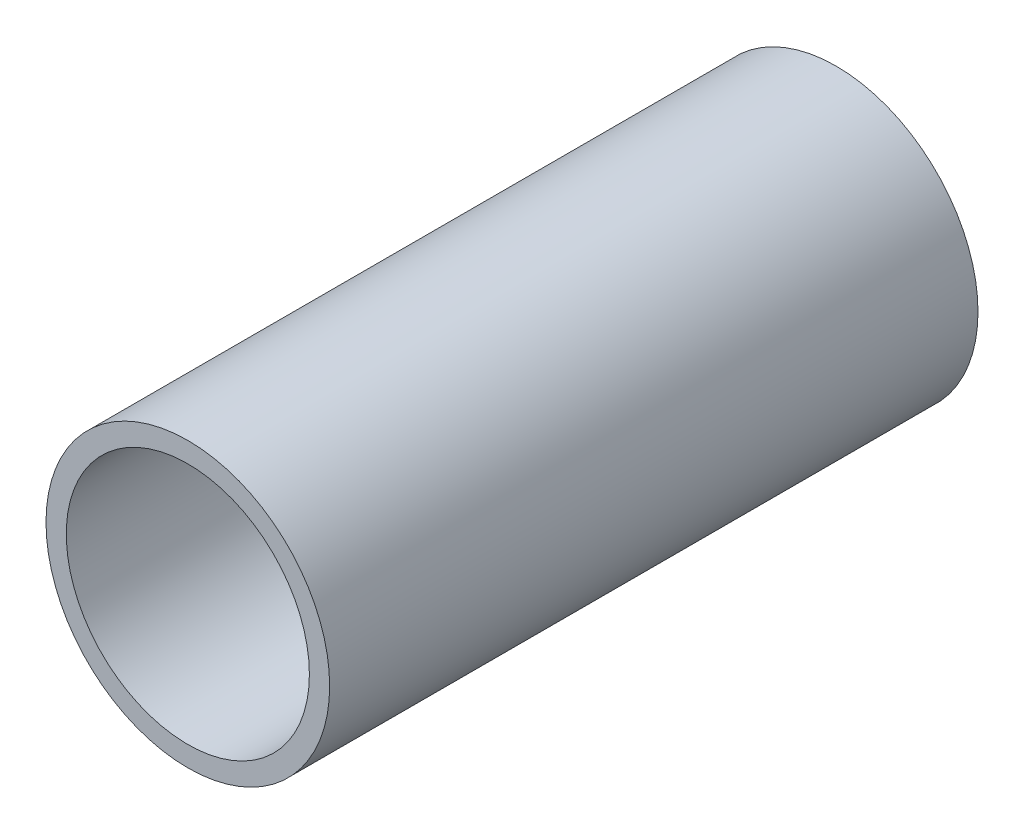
SolidWorks part; units mm, degrees
ref_plane "Front Plane" through (0, 0, 0) normal (0, 0, 1) x (1, 0, 0)
ref_plane "Top Plane" through (0, 0, 0) normal (0, 1, 0) x (1, 0, 0)
ref_plane "Right Plane" through (0, 0, 0) normal (1, 0, 0) x (0, 0, -1)
sketch "Sketch1" plane through (0, 0, 0) normal (0, 0, 1) x (1, 0, 0)
  circle A0 centre (0, 0) radius 38.1
  circle A1 centre (0, 0) radius 44.45
  dimension "D1" = 76.2
  dimension "D2" = 88.9
extrude "Boss-Extrude1" add sketch "Sketch1" along normal blind 203.2
